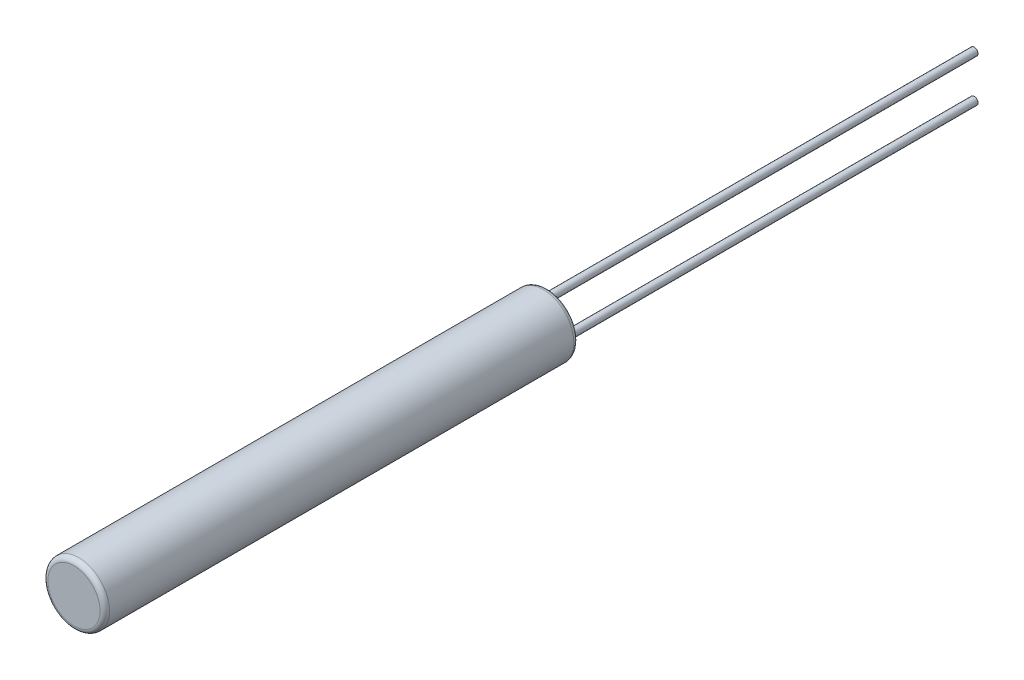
SolidWorks part; units mm, degrees
ref_plane "Plan de face" through (0, 0, 0) normal (0, 0, 1) x (1, 0, 0)
ref_plane "Plan de dessus" through (0, 0, 0) normal (0, 1, 0) x (1, 0, 0)
ref_plane "Plan de droite" through (0, 0, 0) normal (1, 0, 0) x (0, 0, -1)
sketch "Esquisse1" plane through (0, 0, 0) normal (0, 0, 1) x (1, 0, 0)
  circle A0 centre (0, 0) radius 0.65
  dimension "D1" = 1.3
extrude "Boss.-Extru.1" add sketch "Esquisse1" along normal blind 10
sketch "Esquisse2" plane through (0, 0, 0) normal (0, 0, -1) x (-1, 0, 0)
  circle A0 centre (0, -0.45) radius 0.08
  circle A1 centre (0, 0.45) radius 0.08
  dimension "D1" = 0.45
  dimension "D3" = 0.16
  dimension "D2" = 0.45
extrude "Boss.-Extru.2" add sketch "Esquisse2" along normal blind 9
fillet "Congé1" radius 0.1 2 edges at (0.65, 0, 10) (0.65, 0, 0)
